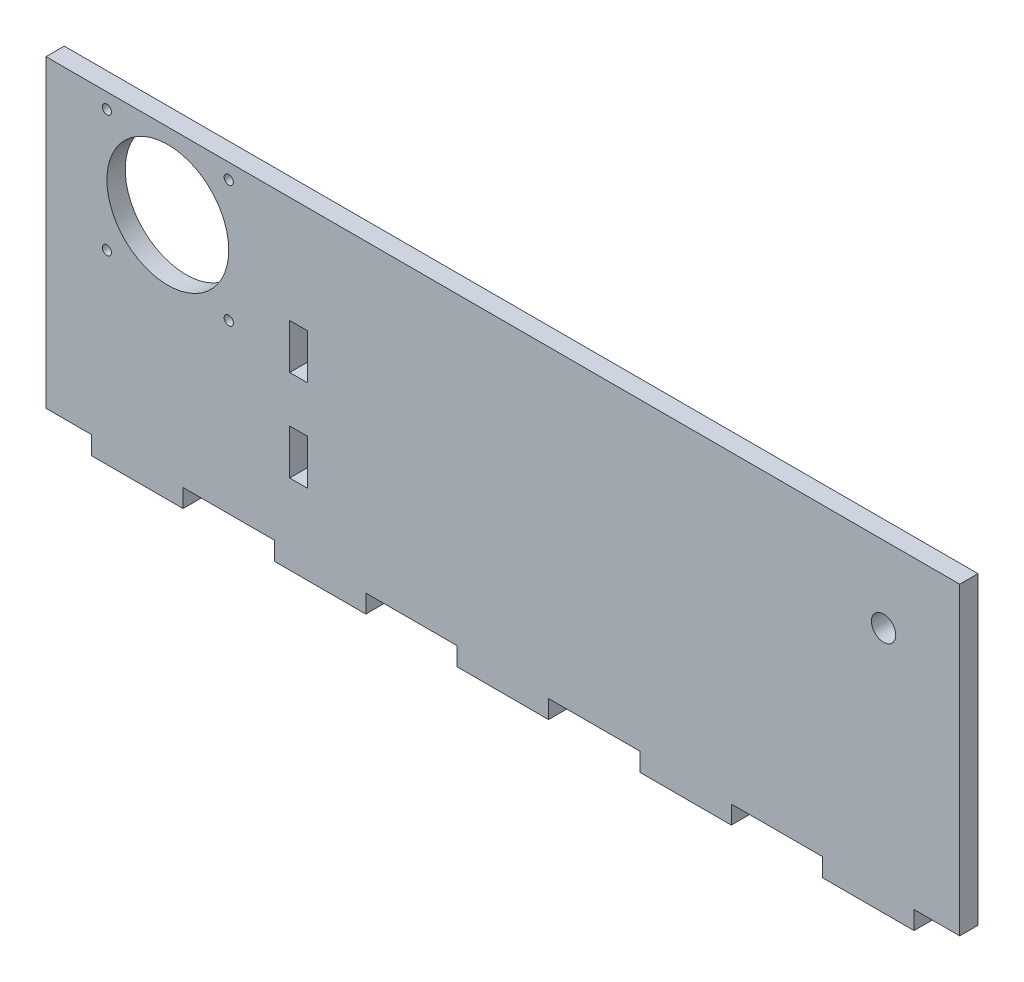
SolidWorks part; units mm, degrees
ref_plane "Alzado" through (0, 0, 0) normal (0, 0, 1) x (1, 0, 0)
ref_plane "Planta" through (0, 0, 0) normal (0, 1, 0) x (1, 0, 0)
ref_plane "Vista lateral" through (0, 0, 0) normal (1, 0, 0) x (0, 0, -1)
sketch "Sketch1" plane through (0, 0, 0) normal (0, 0, 1) x (1, 0, 0)
  line L0 (-75, -56) -> (-45, -56)
  line L1 (-150, -50) -> (-135, -50)
  line L2 (-150, -50) -> (-150, 50)
  line L3 (-150, 50) -> (150, 50)
  line L4 (150, -50) -> (150, 50)
  line L5 (-150, -50) -> (150, 50) construction
  line L6 (-150, 50) -> (150, -50) construction
  line L7 (-45, -50) -> (-15, -50)
  line L8 (-135, -50) -> (-135, -56)
  line L9 (-135, -56) -> (-105, -56)
  line L10 (-105, -50) -> (-105, -56)
  line L11 (-75, -50) -> (-75, -56)
  line L12 (-45, -50) -> (-45, -56)
  line L13 (-15, -56) -> (15, -56)
  line L14 (-15, -50) -> (-15, -56)
  line L15 (15, -50) -> (15, -56)
  line L16 (45, -56) -> (75, -56)
  line L17 (45, -50) -> (45, -56)
  line L18 (75, -50) -> (75, -56)
  line L19 (105, -56) -> (135, -56)
  line L20 (105, -50) -> (105, -56)
  line L21 (135, -50) -> (135, -56)
  line L22 (-105, -50) -> (-75, -50)
  line L23 (15, -50) -> (45, -50)
  line L24 (75, -50) -> (105, -50)
  line L25 (135, -50) -> (150, -50)
  point P0 (0, 0)
  point P10 (-120, -56)
  dimension "D1" = 300
  dimension "D2" = 100
  dimension "D3" = 30
  dimension "D4" = 6
  dimension "D5" = 30
  dimension "D6" = 5
extrude "Boss-Extrude1" add sketch "Sketch1" along normal blind 6
sketch "Sketch2" plane through (0, 0, 6) normal (0, 0, 1) x (1, 0, 0)
  line L0 (-150, 50) -> (-150, -50) construction
  line L1 (150, -50) -> (150, 50) construction
  line L2 (150, 50) -> (-150, 50) construction
  line L3 (-70, 15) -> (-64.2, 15)
  line L4 (-70, 15) -> (-70, 0.2)
  line L5 (-70, 0.2) -> (-64.2, 0.2)
  line L6 (-64.2, 15) -> (-64.2, 0.2)
  line L7 (-70, -15) -> (-64.2, -15)
  line L8 (-70, -15) -> (-70, -29.8)
  line L9 (-70, -29.8) -> (-64.2, -29.8)
  line L10 (-64.2, -15) -> (-64.2, -29.8)
  line L11 (-130, 5) -> (-90, 5) construction
  line L12 (-130, 5) -> (-130, 45) construction
  line L13 (-130, 45) -> (-90, 45) construction
  line L14 (-90, 5) -> (-90, 45) construction
  line L15 (-130, 5) -> (-90, 45) construction
  line L16 (-130, 45) -> (-90, 5) construction
  circle A0 centre (-110, 25) radius 20
  circle A1 centre (-130, 45) radius 1.5
  circle A2 centre (-90, 45) radius 1.5
  circle A3 centre (-90, 5) radius 1.5
  circle A4 centre (-130, 5) radius 1.5
  circle A6 centre (125, 25) radius 4
  point P15 (-64.2, 7.6)
  point P16 (-64.2, -22.4)
  dimension "D1" = 40
  dimension "D2" = 40
  dimension "D3" = 25
  dimension "D6" = 5.8
  dimension "D7" = 14.8
  dimension "D8" = 14.8
  dimension "D9" = 30
  dimension "D13" = 3
  dimension "D14" = 3
  dimension "D15" = 3
  dimension "D16" = 3
  dimension "D19" = 25
  dimension "D20" = 25
  dimension "D21" = 8
  dimension "D4" = 80
  dimension "D5" = 5.8
  dimension "D10" = 35
  dimension "D11" = 40
  dimension "D12" = 40
extrude "Cut-Extrude2" cut sketch "Sketch2" against normal up to next
